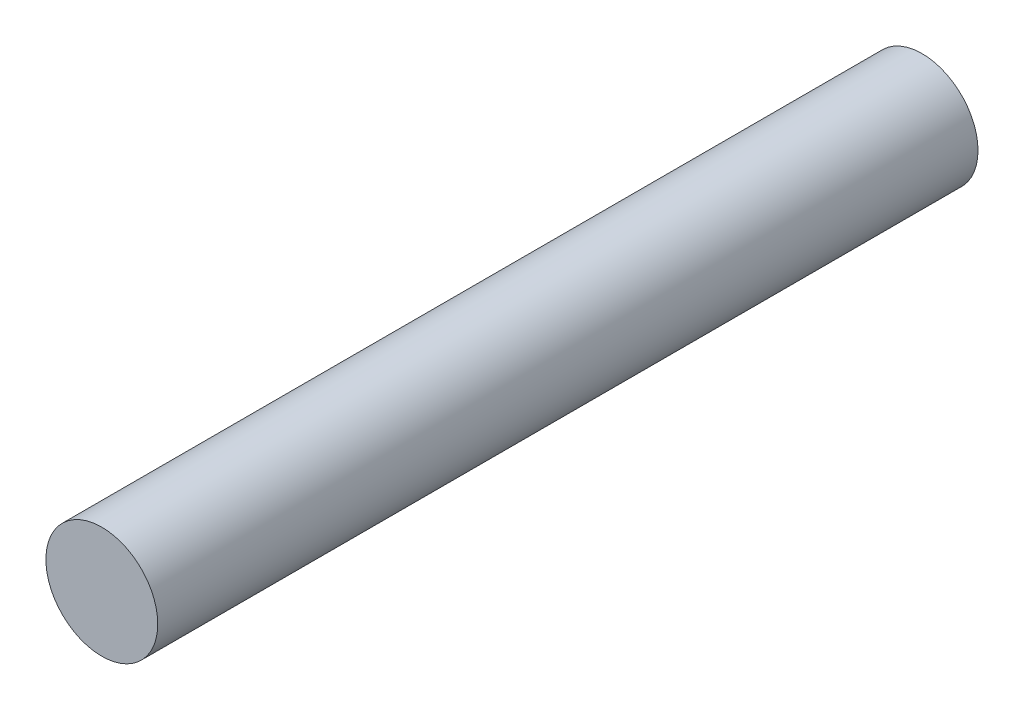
SolidWorks part; units mm, degrees
ref_plane "Front" through (0, 0, 0) normal (0, 0, 1) x (1, 0, 0)
ref_plane "Top" through (0, 0, 0) normal (0, 1, 0) x (1, 0, 0)
ref_plane "Right" through (0, 0, 0) normal (1, 0, 0) x (0, 0, -1)
sketch "Sketch6" plane through (0, 0, 0) normal (0, 0, 1) x (1, 0, 0)
  circle A0 centre (0, 0) radius 7.5
  dimension "D1" = 15
extrude "Boss-Extrude1" add sketch "Sketch6" along normal blind 110
